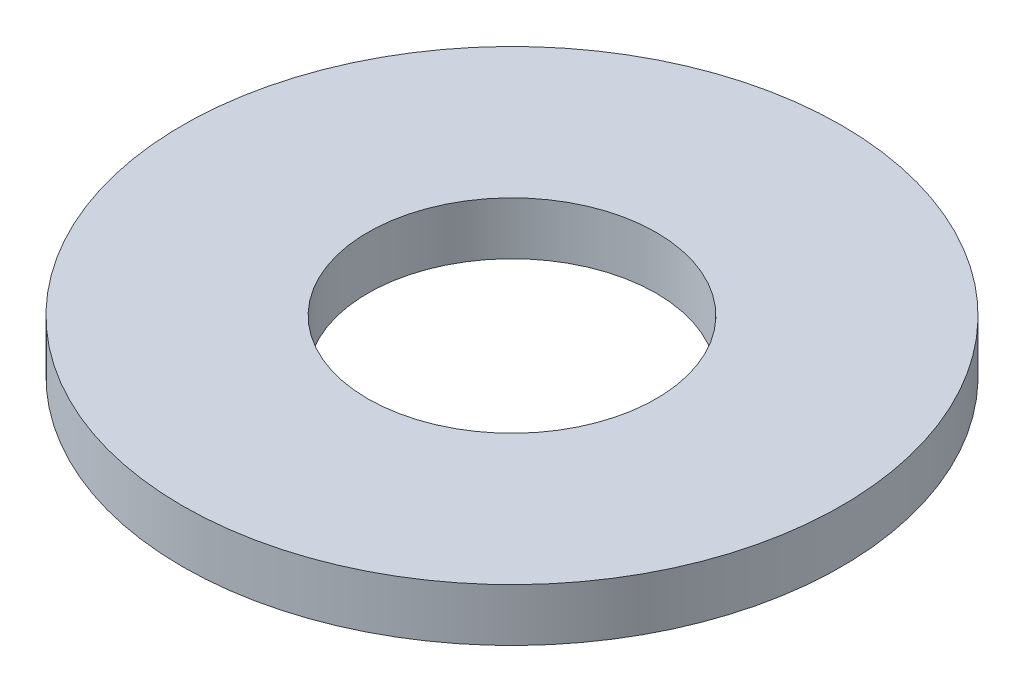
SolidWorks part; units mm, degrees
ref_plane "Plane1" through (0, 0, 0) normal (0, 0, 1) x (1, 0, 0)
ref_plane "Plane2" through (0, 0, 0) normal (0, 1, 0) x (1, 0, 0)
ref_plane "Plane3" through (0, 0, 0) normal (1, 0, 0) x (0, 0, -1)
sketch "Sketch1" plane through (0, 0, 0) normal (0, 1, 0) x (1, 0, 0)
  circle A0 centre (0, 0) radius 3.175
  dimension "B" = 6.35
extrude "Base-Extrude" add sketch "Sketch1" along normal blind 0.508
sketch "Sketch2" plane through (0, 0.508, 0) normal (0, 1, 0) x (-1, 0, 0)
  circle A0 centre (0, 0) radius 1.3891
  dimension "A" = 2.7781
extrude "Cut-Extrude1" cut sketch "Sketch2" against normal up to next
